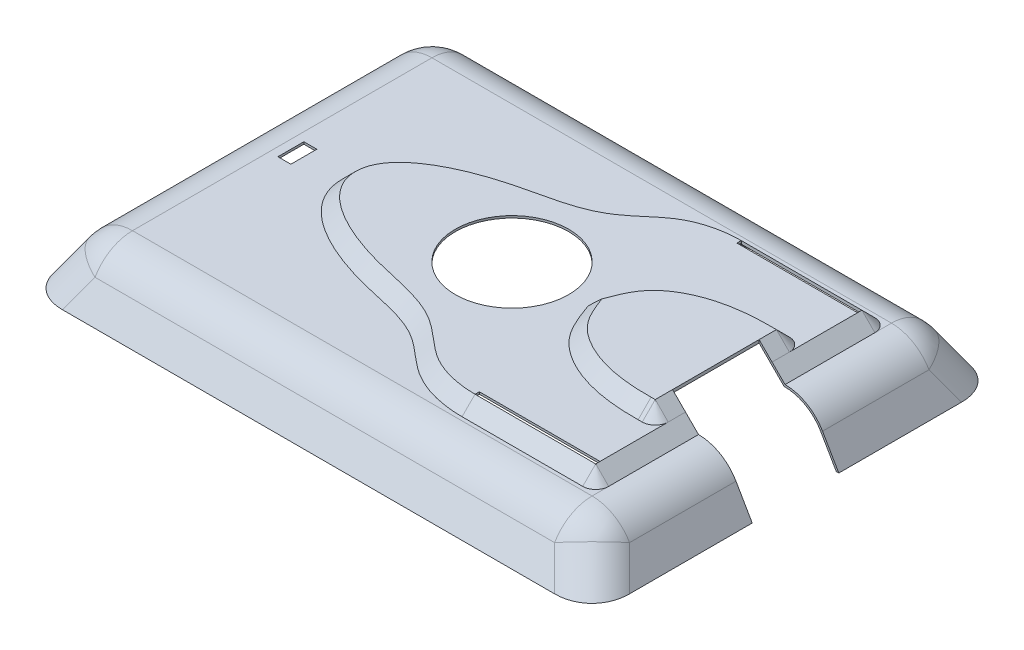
SolidWorks part; units mm, degrees
ref_plane "Plan de face" through (0, 0, 0) normal (0, 0, 1) x (1, 0, 0)
ref_plane "Plan de dessus" through (0, 0, 0) normal (0, 1, 0) x (1, 0, 0)
ref_plane "Plan de droite" through (0, 0, 0) normal (1, 0, 0) x (0, 0, -1)
sketch "Esquisse1" plane through (0, 0, 0) normal (0, 1, 0) x (1, 0, 0)
  line L1 (-131, 94) -> (131, 94)
  line L2 (-131, 94) -> (-131, -94)
  line L3 (-131, -94) -> (131, -94)
  line L4 (131, 94) -> (131, -94)
  dimension "D1" = 262
  dimension "D2" = 188
  dimension "D3" = 131
  dimension "D4" = 94
extrude "Extrusion1" add sketch "Esquisse1" along normal blind 23 draft 30
fillet "Congé2" radius 20 8 edges at (124.3605, 11.5, 87.3605) (124.3605, 11.5, -87.3605) (-124.3605, 11.5, -87.3605) (-124.3605, 11.5, 87.3605) (0, 23, -80.7209) (117.7209, 23, 0) (0, 23, 80.7209) (-117.7209, 23, 0)
sketch "Esquisse8" plane through (0, 23, 0) normal (0, 1, 0) x (-1, 0, 0)
  line L0 (-106.1739, 61.5) -> (-106.1739, -61.5)
  line L2 (-100.1739, 67.5) -> (-44.4137, 67.5)
  line L3 (-106.1739, 69.1739) -> (-106.1739, -69.1739) construction
  line L4 (78.331, 0) -> (78.331, 53.664) construction
  line L6 (-169.6278, 0) -> (96.9484, 0) construction
  line L8 (-100.1739, -67.5) -> (-44.4137, -67.5)
  arc A0 (-106.1739, 61.5) -> (-100.1739, 67.5) centre (-100.1739, 61.5) cw
  arc A1 (-106.1739, -61.5) -> (-100.1739, -67.5) centre (-100.1739, -61.5) ccw
  point P2 (-114.4137, -67.5)
  point P8 (-17.5027, 60.2551)
  point P9 (-0.8706, 47.3756)
  point P10 (32.5939, 36.6753)
  point P15 (-17.5027, -60.2551)
  point P16 (-0.8706, -47.3756)
  point P18 (-158.3287, 0)
  point P19 (-114.4137, 67.5)
  point P21 (32.5939, -36.6753)
  point P25 (-106.1739, 0)
  dimension "D3" = 6
  dimension "D1" = 70
extrude "Extrusion2" add sketch "Esquisse8" along normal blind 6
sketch "Esquisse9" plane through (0, 29, 0) normal (0, 1, 0) x (-1, 0, 0)
  line L0 (-100.1739, 28) -> (-100.1739, -28)
  line L2 (-94.1739, -34) -> (-92.2888, -34)
  line L3 (-15.4262, 0) -> (-154.8388, 0) construction
  line L4 (-94.1739, 34) -> (-92.2888, 34)
  line L5 (12.65, 0) -> (-12.65, 0) construction
  line L7 (-106.1739, 61.5) -> (-106.1739, -61.5) construction
  arc A0 (-94.1739, 34) -> (-100.1739, 28) centre (-94.1739, 28) ccw
  arc A1 (-100.1739, -28) -> (-94.1739, -34) centre (-94.1739, -28) ccw
  point P5 (-64.7149, -30.3715)
  point P7 (-42.9391, -16.2364)
  point P10 (-111, 0)
  point P11 (-64.7149, 30.3715)
  point P14 (-35.1739, 0)
  point P15 (-42.9391, 16.2364)
  point P18 (-100.1739, 34)
  point P21 (-100.1739, -34)
  dimension "D2" = 6
  dimension "D1" = 6
  dimension "D3" = 34
  dimension "D4" = 65
extrude "Extrusion3" add sketch "Esquisse9" along normal blind 6
chamfer "Chanfrein1" distance 6 angle 45 14 edges at (72.2938, 29, 67.5) (104.4166, 29, 65.7426) (104.4166, 29, -65.7426) (106.1739, 29, 0) (72.2938, 29, -67.5) (93.2314, 35, 34) (98.4166, 35, 32.2426) (100.1739, 35, 0) (98.4166, 35, -32.2426) (93.2314, 35, -34)
shell "Coque2" thickness 1
sketch "Esquisse2" plane through (0, 23, 0) normal (0, 1, 0) x (-1, 0, 0)
  circle A0 centre (0, 0) radius 26.2
  dimension "D1" = 52.4
extrude "Enlèv. mat.-Extru.7" cut sketch "Esquisse2" along normal through all
sketch "Esquisse3" plane through (0, 0, 0) normal (0, 1, 0) x (1, 0, 0)
  line L0 (94.1739, -28) -> (94.1739, 28) construction
  line L1 (131, 20) -> (94.1739, 20)
  line L2 (131, 20) -> (131, -20)
  line L3 (131, -20) -> (94.1739, -20)
  line L4 (131, -76.6795) -> (131, 76.6795) construction
  line L9 (94.1739, 20) -> (94.1739, -20)
  dimension "D2" = 40
  dimension "D3" = 20
extrude "Enlèv. mat.-Extru.3" cut sketch "Esquisse3" along normal through all
sketch "Esquisse6" plane through (0, 23, 0) normal (0, 1, 0) x (-1, 0, 0)
  line L0 (19.3052, 0) -> (-19.3052, 0) construction
  line L1 (96.1739, -6) -> (102.1739, -6)
  line L2 (96.1739, -6) -> (96.1739, 6)
  line L3 (96.1739, 6) -> (102.1739, 6)
  line L4 (102.1739, -6) -> (102.1739, 6)
  line L6 (106.1739, -69.1739) -> (106.1739, 69.1739) construction
  line L7 (-100.1739, 61.5) -> (-44.4373, 61.5)
  line L8 (-100.1739, 61.5) -> (-100.1739, 59.5)
  line L9 (-100.1739, 59.5) -> (-44.4373, 59.5)
  line L10 (-44.4373, 61.5) -> (-44.4373, 59.5)
  line L11 (-100.1739, -61.5) -> (-44.4373, -61.5)
  line L12 (-100.1739, -61.5) -> (-100.1739, -59.5)
  line L13 (-100.1739, -59.5) -> (-44.4373, -59.5)
  line L14 (-44.4373, -61.5) -> (-44.4373, -59.5)
  dimension "D1" = 12
  dimension "D2" = 6
  dimension "D3" = 6
  dimension "D4" = 4
  dimension "D5" = 2
extrude "Enlèv. mat.-Extru.5" cut sketch "Esquisse6" against normal mid plane 55
